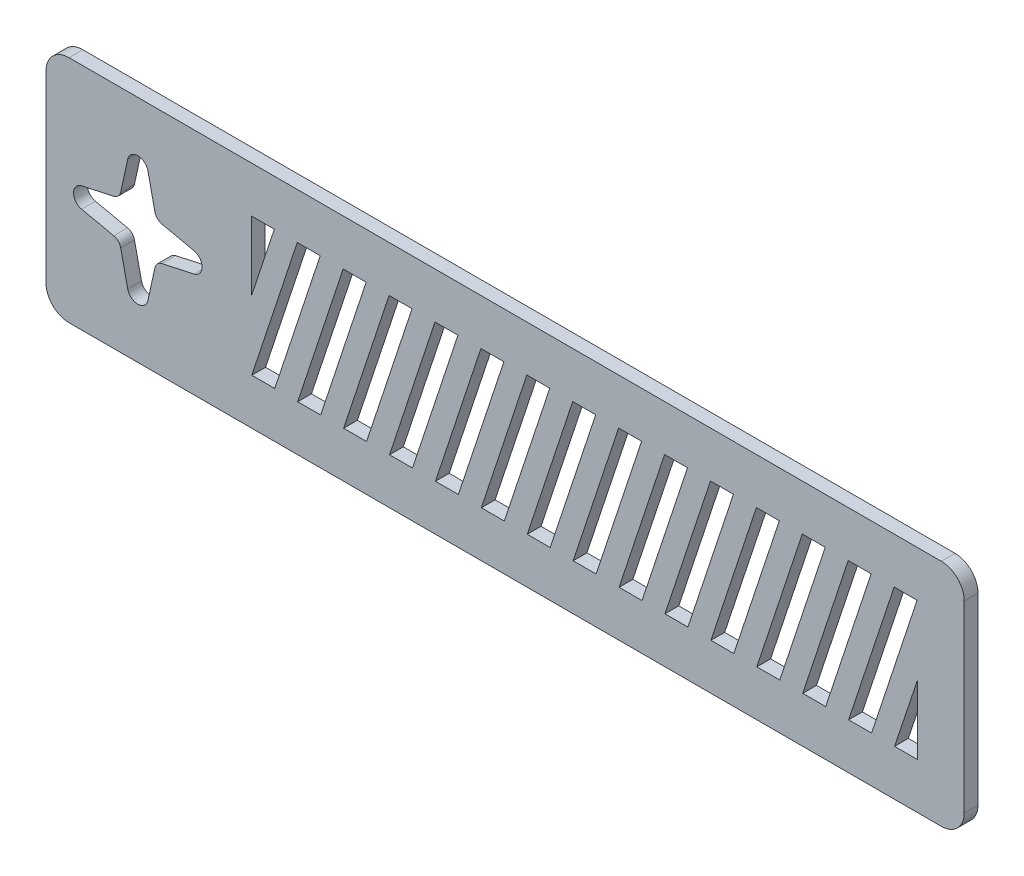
SolidWorks part; units mm, degrees
ref_plane "Plan de face" through (0, 0, 0) normal (0, 0, 1) x (1, 0, 0)
ref_plane "Plan de dessus" through (0, 0, 0) normal (0, 1, 0) x (1, 0, 0)
ref_plane "Plan de droite" through (0, 0, 0) normal (1, 0, 0) x (0, 0, -1)
sketch "Esquisse1" plane through (0, 0, 0) normal (0, 0, 1) x (1, 0, 0)
  line L0 (0, 0) -> (-28, 0) construction
  line L1 (-14, 14) -> (-14, -14) construction
  line L6 (-14, 4) -> (-14, -4) construction
  line L7 (-16.1979, 12.2312) -> (-17.7259, 5.2519)
  line L8 (-19.2519, 3.7259) -> (-26.2312, 2.1979)
  line L9 (-26.2312, -2.1979) -> (-19.2519, -3.7259)
  line L10 (-17.7259, -5.2519) -> (-16.1979, -12.2312)
  line L11 (-10.2741, 5.2519) -> (-11.8021, 12.2312)
  line L12 (-8.7481, 3.7259) -> (-1.7688, 2.1979)
  line L13 (-1.7688, -2.1979) -> (-8.7481, -3.7259)
  line L14 (-10.2741, -5.2519) -> (-11.8021, -12.2312)
  line L15 (90.8231, -15) -> (95.8231, -15)
  line L16 (-29, 25) -> (161, 25)
  line L17 (-34, 20) -> (-34, -20)
  line L18 (-29, -25) -> (161, -25)
  line L19 (166, 20) -> (166, -20)
  line L20 (15.7283, 15) -> (10.7283, -0.1435)
  line L21 (15.7283, 15) -> (10.7283, 15)
  line L24 (10.7283, 15) -> (10.7283, -0.1435)
  line L25 (150.8231, -15) -> (155.8231, -15)
  line L26 (155.8231, -15) -> (155.8231, 0)
  line L27 (155.8231, 0) -> (150.8231, -15)
  line L33 (40.7283, 15) -> (45.7283, 15)
  line L34 (50.7283, 15) -> (55.7283, 15)
  line L35 (60.7283, 15) -> (65.7283, 15)
  line L36 (70.7283, 15) -> (75.7283, 15)
  line L37 (80.7283, 15) -> (85.7283, 15)
  line L38 (90.7283, 15) -> (95.7283, 15)
  line L39 (80.8231, -15) -> (85.8231, -15)
  line L40 (70.8231, -15) -> (75.8231, -15)
  line L41 (60.8231, -15) -> (65.8231, -15)
  line L42 (50.8231, -15) -> (55.8231, -15)
  line L43 (40.8231, -15) -> (45.8231, -15)
  line L44 (30.8231, -15) -> (35.8231, -15)
  line L45 (100.7283, 15) -> (105.7283, 15)
  line L46 (25.7283, 15) -> (15.8231, -15)
  line L47 (20.7283, 15) -> (10.8231, -15)
  line L48 (100.8231, -15) -> (105.8231, -15)
  line L49 (20.7283, 15) -> (25.7283, 15)
  line L50 (10.8231, -15) -> (15.8231, -15)
  line L51 (30.7283, 15) -> (35.7283, 15)
  line L52 (20.8231, -15) -> (25.8231, -15)
  line L53 (30.7283, 15) -> (20.8231, -15)
  line L54 (35.7283, 15) -> (25.8231, -15)
  line L55 (40.7283, 15) -> (30.8231, -15)
  line L56 (45.7283, 15) -> (35.8231, -15)
  line L57 (50.7283, 15) -> (40.8231, -15)
  line L58 (55.7283, 15) -> (45.8231, -15)
  line L59 (60.7283, 15) -> (50.8231, -15)
  line L60 (65.7283, 15) -> (55.8231, -15)
  line L61 (70.7283, 15) -> (60.8231, -15)
  line L62 (75.7283, 15) -> (65.8231, -15)
  line L63 (80.7283, 15) -> (70.8231, -15)
  line L64 (85.7283, 15) -> (75.8231, -15)
  line L65 (90.7283, 15) -> (80.8231, -15)
  line L79 (110.7283, 15) -> (115.7283, 15)
  line L80 (120.7283, 15) -> (125.7283, 15)
  line L81 (130.7283, 15) -> (135.7283, 15)
  line L82 (140.7283, 15) -> (145.7283, 15)
  line L83 (150.7283, 15) -> (155.7283, 15)
  line L84 (110.8231, -15) -> (115.8231, -15)
  line L85 (120.8231, -15) -> (125.8231, -15)
  line L86 (130.8231, -15) -> (135.8231, -15)
  line L87 (140.8231, -15) -> (145.8231, -15)
  line L99 (95.7283, 15) -> (85.8231, -15)
  line L100 (100.7283, 15) -> (90.8231, -15)
  line L101 (105.7283, 15) -> (95.8231, -15)
  line L102 (110.7283, 15) -> (100.8231, -15)
  line L103 (115.7283, 15) -> (105.8231, -15)
  line L104 (120.7283, 15) -> (110.8231, -15)
  line L105 (125.7283, 15) -> (115.8231, -15)
  line L106 (130.7283, 15) -> (120.8231, -15)
  line L107 (135.7283, 15) -> (125.8231, -15)
  line L108 (140.7283, 15) -> (130.8231, -15)
  line L109 (145.7283, 15) -> (135.8231, -15)
  line L110 (150.7283, 15) -> (140.8231, -15)
  line L111 (155.7283, 15) -> (145.8231, -15)
  arc A0 (-11.8021, 12.2312) -> (-16.1979, 12.2312) centre (-14, 11.75) ccw
  arc A1 (-1.7688, -2.1979) -> (-1.7688, 2.1979) centre (-2.25, 0) ccw
  arc A2 (-26.2312, 2.1979) -> (-26.2312, -2.1979) centre (-25.75, 0) ccw
  arc A3 (-16.1979, -12.2312) -> (-11.8021, -12.2312) centre (-14, -11.75) ccw
  arc A4 (-8.7481, 3.7259) -> (-10.2741, 5.2519) centre (-8.3204, 5.6796) cw
  arc A5 (-10.2741, -5.2519) -> (-8.7481, -3.7259) centre (-8.3204, -5.6796) cw
  arc A6 (-17.7259, -5.2519) -> (-19.2519, -3.7259) centre (-19.6796, -5.6796) ccw
  arc A7 (-19.2519, 3.7259) -> (-17.7259, 5.2519) centre (-19.6796, 5.6796) ccw
  arc A8 (-34, -20) -> (-29, -25) centre (-29, -20) ccw
  arc A9 (-29, 25) -> (-34, 20) centre (-29, 20) ccw
  arc A10 (161, -25) -> (166, -20) centre (161, -20) ccw
  arc A11 (161, 25) -> (166, 20) centre (161, 20) cw
  point P5 (-14, 0)
  point P6 (-14, 0)
  point P13 (-14, 0)
  point P27 (-10, 4)
  point P33 (-18, -4)
  point P36 (-18, 4)
  point P52 (-34, -25)
  point P55 (-34, 25)
  point P60 (166, 25)
  dimension "D6" = 4.5
  dimension "D8" = 4.5
  dimension "D10" = 4.5
  dimension "D11" = 2.25
  dimension "D12" = 4.5
  dimension "D5" = 2
  dimension "D26" = 5
  dimension "D1" = 28
  dimension "D2" = 28
  dimension "D3" = 8
  dimension "D4" = 8
  dimension "D7" = 2.25
  dimension "D9" = 2.25
  dimension "D13" = 2.25
  dimension "D14" = 50
  dimension "D15" = 200
  dimension "D16" = 25
  dimension "D17" = 20
  dimension "D19" = 5
  dimension "D20" = 10
  dimension "D21" = 10
  dimension "D18" = 5
  dimension "D22" = 54.7283
  dimension "D23" = 5
  dimension "D24" = 5
  dimension "D25" = 15
extrude "Boss.-Extru.1" add sketch "Esquisse1" along normal blind 3
